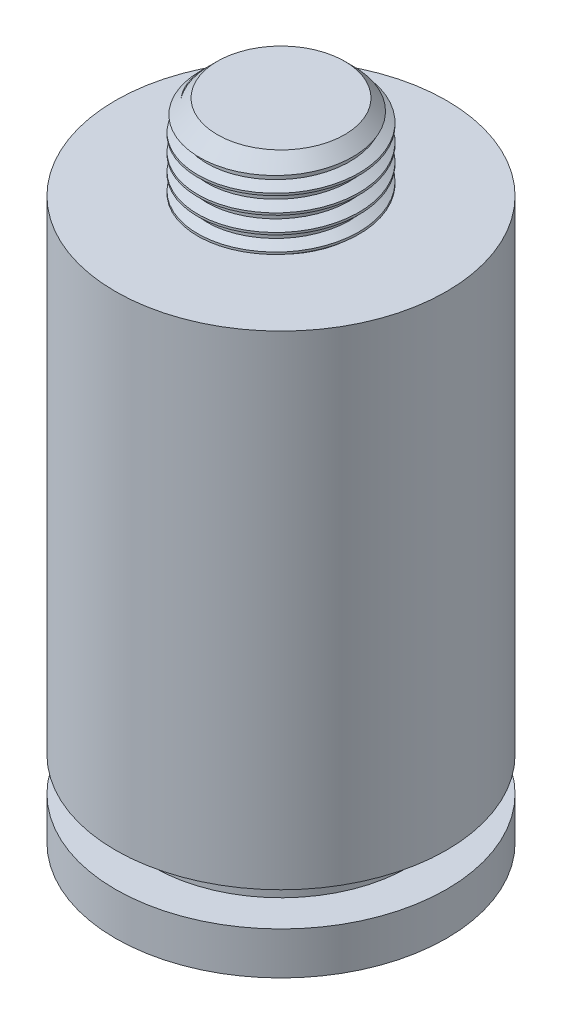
SolidWorks part; units mm, degrees
ref_plane "Front Plane" through (0, 0, 0) normal (0, 0, 1) x (1, 0, 0)
ref_plane "Top Plane" through (0, 0, 0) normal (0, 1, 0) x (1, 0, 0)
ref_plane "Right Plane" through (0, 0, 0) normal (1, 0, 0) x (0, 0, -1)
sketch "Sketch1" plane through (0, 0, 0) normal (0, 0, 1) x (1, 0, 0)
  line L0 (0, 41.163) -> (0, -32.2083) construction
  line L1 (-9.75, 33) -> (-4.75, 33)
  line L2 (0, 38) -> (-3.75, 38)
  line L3 (0, 38) -> (0, 0)
  line L4 (0, 0) -> (-9.75, 0)
  line L5 (-9.75, 33) -> (-9.75, 4.5)
  line L6 (-4.75, 33) -> (-4.75, 37)
  line L7 (-4.75, 37) -> (-3.75, 38)
  line L8 (-9.75, 2.5) -> (-9.75, 0)
  line L9 (-9.75, 4.5) -> (-7.5, 4.5)
  line L11 (-9.75, 2.5) -> (-7.5, 2.5)
  line L12 (-7.5, 4.5) -> (-7.5, 2.5)
  dimension "D1" = 38
  dimension "D2" = 135
  dimension "D3" = 1
  dimension "D4" = 9.5
  dimension "D5" = 19.5
  dimension "D6" = 5
  dimension "D7" = 28.5
  dimension "D8" = 2
  dimension "D9" = 15
revolve "Revolve1" add sketch "Sketch1" angle 360 about L0
thread "Thread1" pitch 1 start angle 0, offset 5, length 10, pitch 1, diameter 9.5
ref_plane "Plane1" through (-4.75, 42, 0) normal (0, 0, 1) x (-1, 0, 0)
sketch "Thread Profile1" plane through (-4.75, 42, 0) normal (0, 0, 1) x (-1, 0, 0)
  line L0 (0, 0) -> (0, 1) construction
  line L11 (0, 0) -> (0, 0.875)
  line L12 (0, 0.875) -> (-0.5413, 0.5625)
  line L13 (-0.5413, 0.5625) -> (-0.5413, 0.3125)
  line L15 (-0.5413, 0.3125) -> (0, 0)
  line L17 (-0.5413, 0.4375) -> (0, 0.4375) construction
  point P2 (0, 0)
  dimension "Pitch" = 1
  dimension "Profile_Angle" = 60
  dimension "Profile_Land" = 0.25
  dimension "Profile_Height" = 0.5413
